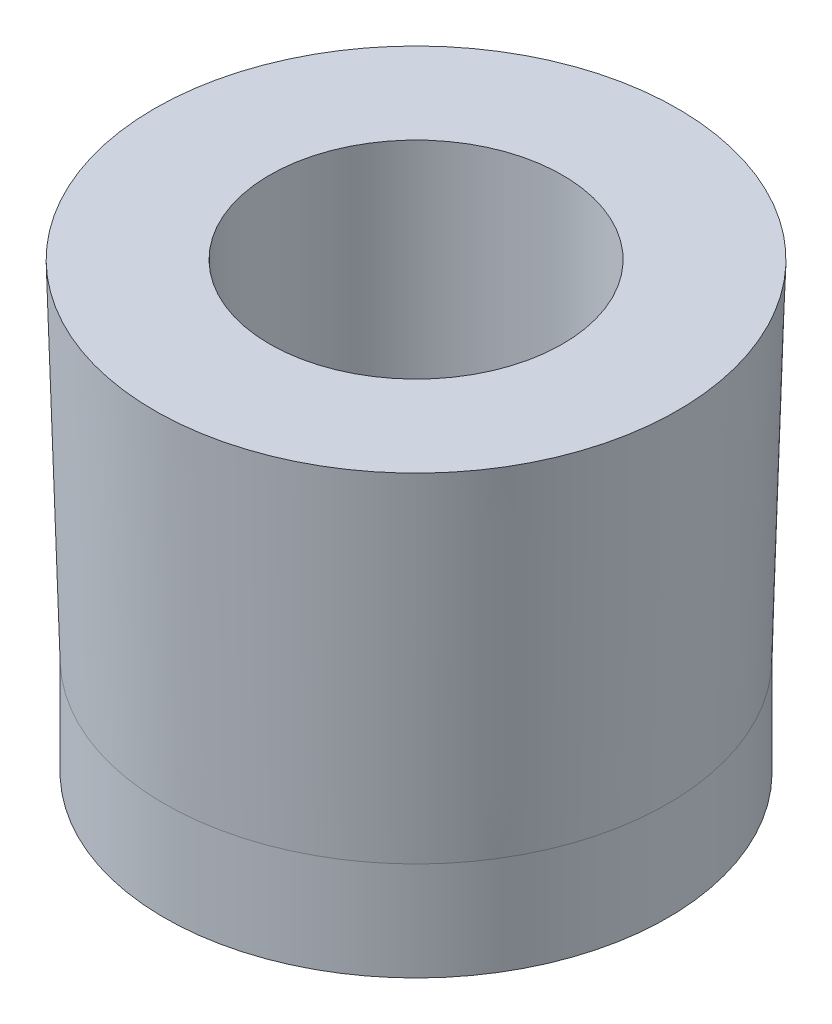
SolidWorks part; units mm, degrees
ref_plane "Front" through (0, 0, 0) normal (0, 0, 1) x (1, 0, 0)
ref_plane "Top" through (0, 0, 0) normal (0, 1, 0) x (1, 0, 0)
ref_plane "Right" through (0, 0, 0) normal (1, 0, 0) x (0, 0, -1)
sketch "Sketch1" plane through (0, 0, 0) normal (0, 0, 1) x (1, 0, 0)
  line L0 (0, 0) -> (0, -1.778) construction
  line L1 (0, -0.889) -> (2.0193, -0.889)
  line L2 (2.0193, -0.889) -> (1.9431, -3.556)
  line L3 (1.9431, -3.556) -> (1.9431, -4.318)
  line L4 (1.9431, -4.318) -> (0, -4.318)
  line L5 (0, -4.318) -> (0, -0.889)
  dimension "D1" = 3.8862
  dimension "D2" = 4.0386
  dimension "D3" = 3.429
  dimension "D4" = 0.889
  dimension "D5" = 0.762
revolve "Revolve1" add sketch "Sketch1" angle 360 about L0
hole_wizard "#4-40 Tapped Hole1" positions "Sketch3" profile "Sketch2" tap size "#4-40" standard "Ansi Inch"
sketch "Sketch3" plane through (0, -0.889, 0) normal (0, 1, 0) x (-1, 0, 0)
  circle A0 centre (0, 0) radius 2.0193 construction
  point P0 (0, 0)
sketch "Sketch2" plane through (0, -0.889, 0) normal (1, 0, 0) x (0, 0, 1)
  line L0 (0, 0) -> (0, 3.429)
  line L1 (0, 3.429) -> (1.1303, 3.429)
  line L2 (1.1303, 3.429) -> (1.1303, 0)
  line L5 (1.1303, 0) -> (0, 0)
  line L11 (0, -6.35) -> (0, 107.95) construction
  dimension "Thru Tap Drill Dia." = 2.2606
  dimension "Thru Tap Drill Depth" = 3.429
